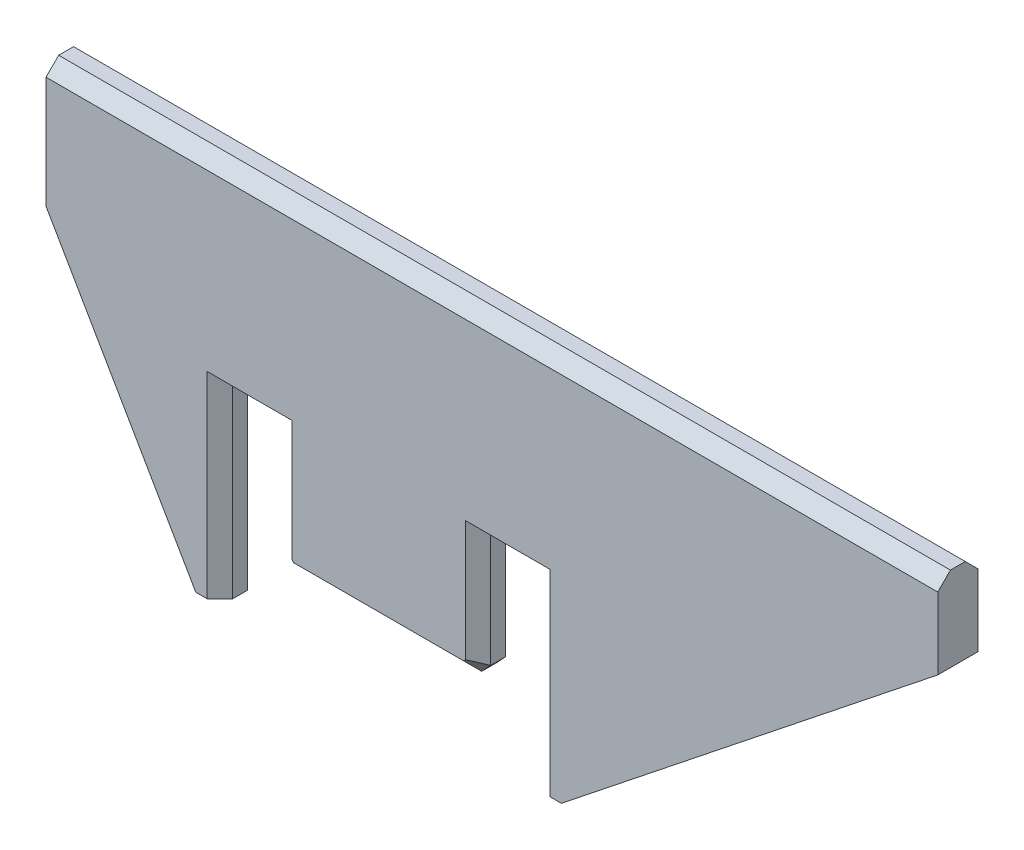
SolidWorks part; units mm, degrees
ref_plane "Front Plane" through (0, 0, 0) normal (1, 0, 0) x (0, 1, 0)
ref_plane "Top Plane" through (0, 0, 0) normal (0, 0, 1) x (0, 1, 0)
ref_plane "Right Plane" through (0, 0, 0) normal (0, 1, 0) x (-1, 0, 0)
sketch "sk w193" plane through (0, 0, 0) normal (0, 0, 1) x (0, 1, 0)
  line L1 (-443.3612, -196.596) -> (0, -196.596)
  line L2 (-443.3612, -196.596) -> (-443.3612, -247.396)
  line L3 (-443.3612, -247.396) -> (0, -247.396)
  line L4 (0, -196.596) -> (0, -247.396)
  line L6 (-443.3612, 247.396) -> (0, 247.396)
  line L7 (-443.3612, 247.396) -> (-443.3612, 196.596)
  line L8 (-443.3612, 196.596) -> (0, 196.596)
  line L9 (0, 247.396) -> (0, 196.596)
  point P0 (-399.034, -196.596)
  point P3 (-188.214, 0)
  line B0 (-399.034, -196.596) -> (-399.034, -160.02)
  line B1 (-399.034, -160.02) -> (-226.06, -160.02)
  line B2 (-210.82, -144.78) -> (-210.82, 144.78)
  line B3 (-226.06, 160.02) -> (-399.034, 160.02)
  line B4 (-399.034, 160.02) -> (-399.034, 196.596)
  line B5 (-399.034, 196.596) -> (0, 196.596)
  line B6 (0, 196.596) -> (0, 160.02)
  line B7 (0, 160.02) -> (-172.974, 160.02)
  line B8 (-188.214, 144.78) -> (-188.214, -144.78)
  line B9 (-172.974, -160.02) -> (0, -160.02)
  line B10 (0, -160.02) -> (0, -196.596)
  line B11 (0, -196.596) -> (-399.034, -196.596)
  arc B12 (-226.06, -160.02) -> (-210.82, -144.78) centre (-226.06, -144.78) ccw
  arc B13 (-210.82, 144.78) -> (-226.06, 160.02) centre (-226.06, 144.78) ccw
  arc B14 (-172.974, 160.02) -> (-188.214, 144.78) centre (-172.974, 144.78) ccw
  arc B15 (-188.214, -144.78) -> (-172.974, -160.02) centre (-172.974, -144.78) ccw
  dimension "D1" = 50.8
  dimension "D2" = 50.8
sketch_block_instance "w14x193-1-1"
sketch_block "w14x193-1" parameters "D4"=15.24, "D1"=399.034, "D2"=393.192, "D3"=22.606, "D5"=36.576
sketch "Sketch2" plane through (0, 0, 0) normal (0, 0, 1) x (0, 1, 0)
  line L0 (320, 524.8782) -> (320, -882.4965)
  line L6 (5, 250.396) -> (5, 157.02)
  line L7 (0, 196.596) -> (0, 160.02) construction
  line L8 (5, -157.02) -> (5, -250.396)
  line L9 (-285.82, 250.396) -> (5, 250.396)
  line L10 (-285.82, -250.396) -> (5, -250.396)
  line L11 (-285.82, 250.396) -> (-285.82, 288.496)
  line L12 (-285.82, 288.496) -> (123.6059, 524.8782)
  line L13 (-285.82, -250.396) -> (-285.82, -288.496)
  line L14 (-285.82, -288.496) -> (186.6693, -882.4965)
  line L15 (-210.82, -144.78) -> (-210.82, 144.78) construction
  line L16 (-188.214, -142.78) -> (-172.974, -157.02)
  line L17 (-188.214, 142.78) -> (-172.974, 157.02)
  line L20 (-443.3612, -247.396) -> (0, -247.396) construction
  line L21 (-443.3612, 247.396) -> (0, 247.396) construction
  line L22 (5, -157.02) -> (-172.974, -157.02)
  line L24 (-188.214, -142.78) -> (-188.214, 142.78)
  line L26 (-172.974, 157.02) -> (5, 157.02)
  line L29 (-188.214, 144.78) -> (-188.214, -144.78) construction
  line L30 (0, 160.02) -> (-172.974, 160.02) construction
  line L31 (-172.974, -160.02) -> (0, -160.02) construction
  line L32 (320, 524.8782) -> (123.6059, 524.8782)
  line L35 (320, -882.4965) -> (186.6693, -882.4965)
  dimension "D1" = 320
  dimension "D2" = 5
  dimension "D3" = 75
  dimension "D4" = 3
  dimension "D5" = 3
  dimension "D6" = 30
  dimension "D7" = 51.5
  dimension "D8" = 38.1
  dimension "D9" = 38.1
  dimension "D10" = 882.4965
  dimension "D11" = 3
  dimension "D12" = 3
  dimension "D13" = 2
  dimension "D14" = 2
  dimension "D15" = 1407.3747
extrude "Boss-Extrude1" add sketch "Sketch2" along normal mid plane 63.5
chamfer "Chamfer1" distance 20 angle 45 12 edges at (178.8092, 320, 31.75) (250.396, -285.82, 0) (-250.396, -285.82, 0) (250.396, -140.41, 31.75) (203.708, 5, 31.75) (157.02, -83.987, 31.75) (149.9, -180.594, 31.75) (0, -188.214, 31.75) (-149.9, -180.594, 31.75) (-157.02, -83.987, 31.75) (-203.708, 5, 31.75) (-250.396, -140.41, 31.75)
chamfer "Chamfer2" distance 20 angle 45 10 edges at (178.8092, 320, -31.75) (250.396, -140.41, -31.75) (203.708, 5, -31.75) (157.02, -83.987, -31.75) (149.9, -180.594, -31.75) (0, -188.214, -31.75) (-149.9, -180.594, -31.75) (-157.02, -83.987, -31.75) (-203.708, 5, -31.75) (-250.396, -140.41, -31.75)
